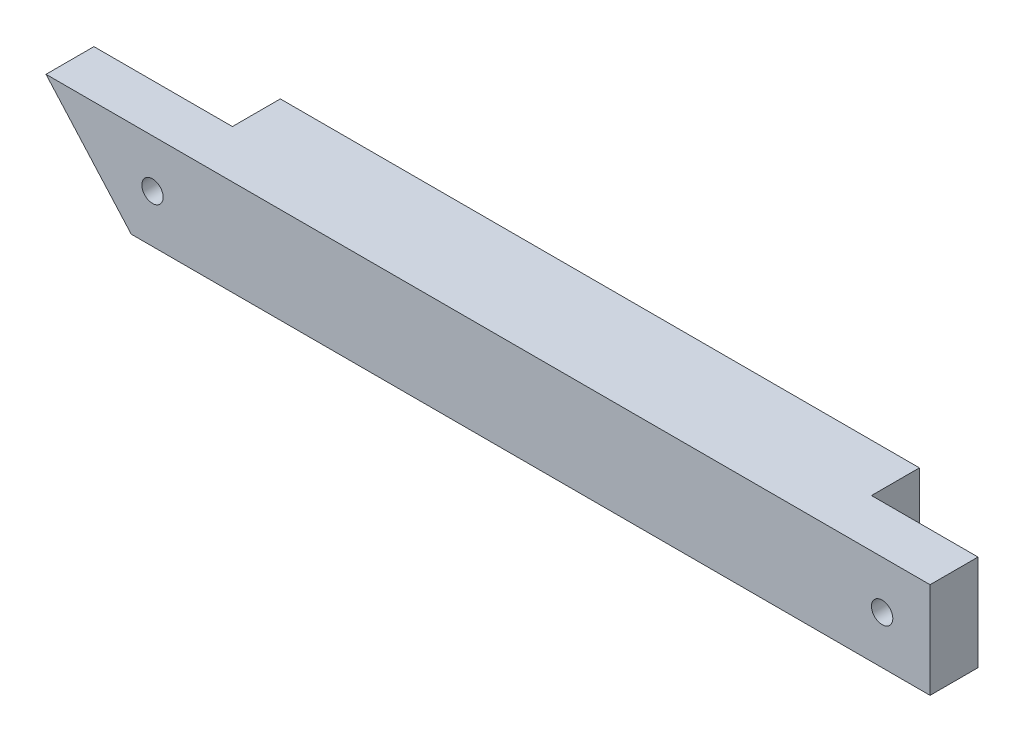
SolidWorks part; units mm, degrees
ref_plane "Plan de face" through (0, 0, 0) normal (0, 0, 1) x (1, 0, 0)
ref_plane "Plan de dessus" through (0, 0, 0) normal (0, 1, 0) x (1, 0, 0)
ref_plane "Plan de droite" through (0, 0, 0) normal (1, 0, 0) x (0, 0, -1)
sketch "Esquisse1" plane through (0, 0, 0) normal (0, 0, 1) x (1, 0, 0)
  line L1 (0, 0) -> (83, 0)
  line L2 (0, 0) -> (0, 9)
  line L3 (0, 9) -> (83, 9)
  line L4 (83, 0) -> (83, 9)
  dimension "D1" = 83
  dimension "D2" = 9
extrude "Extrusion1" add sketch "Esquisse1" along normal blind 9
sketch "Esquisse2" plane through (0, 0, 0) normal (0, 0, -1) x (-1, 0, 0)
  line L0 (-83, 9) -> (0, 9) construction
  line L1 (-83, 0) -> (-73, 0)
  line L2 (-83, 0) -> (-83, 9)
  line L3 (-83, 9) -> (-73, 9)
  line L4 (-73, 0) -> (-73, 9)
  dimension "D1" = 10
extrude "Enlèv. mat.-Extru.1" cut sketch "Esquisse2" against normal blind 4.5
sketch "Esquisse3" plane through (0, 0, 4.5) normal (0, 0, -1) x (-1, 0, 0)
  line L0 (-83, 9) -> (-83, 0) construction
  line L1 (-73, 9) -> (-83, 9) construction
  circle A0 centre (-78.5, 4.5) radius 1
  dimension "D3" = 2
  dimension "D1" = 4.5
  dimension "D2" = 4.5
extrude "Enlèv. mat.-Extru.2" cut sketch "Esquisse3" against normal blind 4.5
sketch "Esquisse4" plane through (0, 0, 0) normal (0, 0, -1) x (-1, 0, 0)
  line L0 (0, 9) -> (-8, 0)
  line L1 (0, 0) -> (-73, 0) construction
  line L2 (-8, 0) -> (0, 0)
  line L3 (0, 0) -> (0, 9)
  dimension "D1" = 8
extrude "Enlèv. mat.-Extru.3" cut sketch "Esquisse4" against normal blind 9
sketch "Esquisse5" plane through (0, 0, 0) normal (0, 0, -1) x (-1, 0, 0)
  line L0 (0, 9) -> (-13, 9)
  line L1 (-73, 9) -> (0, 9) construction
  line L2 (-13, 9) -> (-21, 0)
  line L3 (-8, 0) -> (-73, 0) construction
  line L4 (-21, 0) -> (-8, 0)
  line L5 (-8, 0) -> (0, 9)
  dimension "D1" = 13
  dimension "D2" = 13
extrude "Enlèv. mat.-Extru.4" cut sketch "Esquisse5" against normal blind 4.5
sketch "Esquisse6" plane through (0, 0, 4.5) normal (0, 0, -1) x (-1, 0, 0)
  line L0 (-21, 0) -> (-8, 0) construction
  circle A0 centre (-10, 4.5) radius 1
  dimension "D3" = 2
  dimension "D1" = 10
  dimension "D2" = 4.5
extrude "Enlèv. mat.-Extru.5" cut sketch "Esquisse6" against normal blind 4.5
